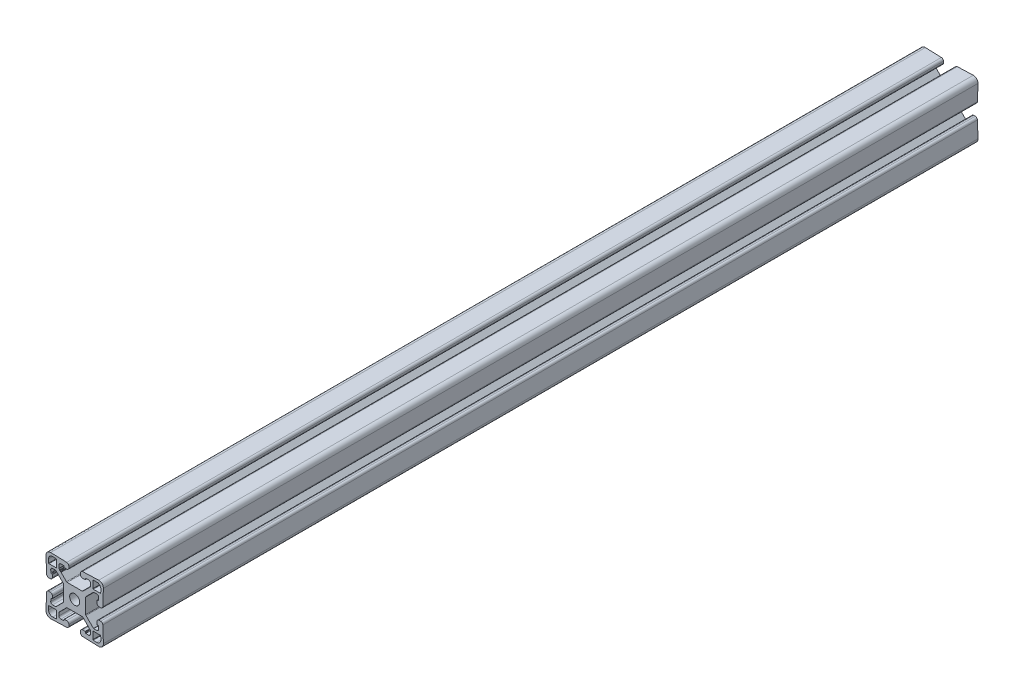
SolidWorks part; units mm, degrees
ref_plane "Front Plane" through (0, 0, 0) normal (0, 0, 1) x (1, 0, 0)
ref_plane "Top Plane" through (0, 0, 0) normal (0, 1, 0) x (1, 0, 0)
ref_plane "Right Plane" through (0, 0, 0) normal (1, 0, 0) x (0, 0, -1)
sketch "Sketch1" plane through (0, 0, 0) normal (0, 0, 1) x (1, 0, 0)
  line L0 (0, 0) -> (0, 20) construction
  line L1 (0, 0) -> (20, 0) construction
  line L2 (0, 0) -> (-20, 20) construction
  line L3 (-16.7142, 19.9981) -> (-5.5358, 19.6077)
  line L4 (-20, 20) -> (0, 20) construction
  line L5 (-4.064, 18.0836) -> (-4.064, 17.069)
  line L6 (-5.6422, 15.5449) -> (-7.1936, 15.5991)
  line L7 (-7.5, 15.9164) -> (-7.5, 16.3198)
  line L8 (-7.8064, 16.6371) -> (-9.6857, 16.7028)
  line L9 (-11, 15.4335) -> (-11, 13.2868)
  line L10 (0, 7.681) -> (-5.2101, 7.681)
  line L11 (-5.7489, 7.9042) -> (-10.907, 13.0623)
  line L12 (-7.9042, 5.7489) -> (-13.0623, 10.907)
  line L13 (-7.681, 0) -> (-7.681, 5.2101)
  line L14 (-15.4335, 11) -> (-13.2868, 11)
  line L15 (-16.6371, 7.8064) -> (-16.7028, 9.6857)
  line L16 (-15.9164, 7.5) -> (-16.3198, 7.5)
  line L17 (-15.5449, 5.6422) -> (-15.5991, 7.1936)
  line L18 (-18.0836, 4.064) -> (-17.069, 4.064)
  line L19 (-19.9981, 16.7142) -> (-19.6077, 5.5358)
  line L20 (-18.2207, 15.3309) -> (-18.1275, 12.661)
  line L21 (-15.3309, 18.2207) -> (-12.661, 18.1275)
  line L22 (-18.1275, 12.661) -> (-12.661, 12.661)
  line L23 (-12.661, 18.1275) -> (-12.661, 12.661)
  line L24 (0, 0) -> (-20, 0) construction
  line L25 (-20, 0) -> (0, 0) construction
  line L26 (0, 0) -> (0, -20) construction
  line L27 (-20, -20) -> (-20, 20) construction
  line L28 (0, 20) -> (20, 20) construction
  line L29 (0, -1000) -> (0, 49000)
  line L30 (-20, -20) -> (20, -20) construction
  arc A0 (-19.9981, 16.7142) -> (-16.7142, 19.9981) centre (-16.825, 16.825) cw
  arc A1 (-7.1936, 15.5991) -> (-7.5, 15.9164) centre (-7.1825, 15.9164) cw
  arc A2 (-7.5, 16.3198) -> (-7.8064, 16.6371) centre (-7.8175, 16.3198) ccw
  arc A3 (-9.6857, 16.7028) -> (-11, 15.4335) centre (-9.73, 15.4335) ccw
  arc A4 (-4.064, 17.069) -> (-5.6422, 15.5449) centre (-5.589, 17.069) cw
  arc A5 (-5.5358, 19.6077) -> (-4.064, 18.0836) centre (-5.589, 18.0836) cw
  arc A6 (-5.2101, 7.681) -> (-5.7489, 7.9042) centre (-5.2101, 8.443) cw
  arc A7 (-7.9042, 5.7489) -> (-7.681, 5.2101) centre (-8.443, 5.2101) cw
  arc A8 (-11, 13.2868) -> (-10.907, 13.0623) centre (-10.6825, 13.2868) ccw
  arc A9 (-18.0836, 4.064) -> (-19.6077, 5.5358) centre (-18.0836, 5.589) cw
  arc A10 (-15.5449, 5.6422) -> (-17.069, 4.064) centre (-17.069, 5.589) cw
  arc A11 (-15.9164, 7.5) -> (-15.5991, 7.1936) centre (-15.9164, 7.1825) cw
  arc A12 (-16.6371, 7.8064) -> (-16.3198, 7.5) centre (-16.3198, 7.8175) ccw
  arc A13 (-15.4335, 11) -> (-16.7028, 9.6857) centre (-15.4335, 9.73) ccw
  arc A14 (-13.0623, 10.907) -> (-13.2868, 11) centre (-13.2868, 10.6825) ccw
  arc A15 (-15.3309, 18.2207) -> (-18.2207, 15.3309) centre (-15.4284, 15.4284) ccw
  circle A16 centre (0, 0) radius 3.5
  point P26 (-7.5, 15.6098)
  point P29 (-7.5, 16.6264)
  point P32 (-11, 16.7487)
  point P35 (-4.064, 15.4898)
  point P38 (-4.064, 19.5563)
  point P42 (-5.5257, 7.681)
  point P45 (-7.681, 5.5257)
  point P48 (-11, 13.1553)
  point P51 (-19.5563, 4.064)
  point P54 (-15.4898, 4.064)
  point P57 (-15.6098, 7.5)
  point P60 (-16.6264, 7.5)
  point P63 (-16.7487, 11)
  point P66 (-13.1553, 11)
  point P80 (-20, 0)
  point P85 (0, -20)
  point P88 (0, -20)
sketch "Sketch2" plane through (0, 0, 0) normal (1, 0, 0) x (0, 0, -1)
  line L0 (-304.8, 0) -> (304.8, 0)
  line L1 (-304.8, -20) -> (-304.8, 20) construction
  line L2 (0, 0) -> (0, 20) construction
  line L3 (0, 0) -> (0, 20) construction
  line L4 (304.8, -20) -> (304.8, 20) construction
  point P0 (-244.8, 0)
  point P3 (0, 0)
  point P7 (244.8, 0)
  point P11 (-304.8, 0)
  point P14 (304.8, 0)
sketch "Sketch3" plane through (0, 0, 0) normal (0, 0, 1) x (1, 0, 0)
  line L0 (-7.681, 0) -> (-7.681, 5.2101) construction
  line L1 (-7.9042, 5.7489) -> (-13.0623, 10.907) construction
  line L2 (-15.4335, 11) -> (-13.2868, 11) construction
  line L3 (-16.6371, 7.8064) -> (-16.7028, 9.6857) construction
  line L4 (-18.2207, 15.3309) -> (-18.1275, 12.661)
  line L5 (-18.1275, 12.661) -> (-12.661, 12.661)
  line L6 (-12.661, 12.661) -> (-12.661, 18.1275)
  line L7 (-12.661, 18.1275) -> (-15.3309, 18.2207)
  line L8 (-18.2207, 15.3309) -> (-18.136, 12.9061)
  line L9 (-17.8822, 12.661) -> (-12.915, 12.661)
  line L10 (-12.661, 12.915) -> (-12.661, 17.8822)
  line L11 (-12.9061, 18.136) -> (-15.3309, 18.2207)
  line L12 (-15.9164, 7.5) -> (-16.3198, 7.5) construction
  line L13 (-15.5449, 5.6422) -> (-15.5991, 7.1936) construction
  line L14 (-18.0836, 4.064) -> (-17.069, 4.064) construction
  line L15 (-19.9981, 16.7142) -> (-19.6077, 5.5358) construction
  line L16 (-16.7142, 19.9981) -> (-5.5358, 19.6077) construction
  line L17 (-4.064, 18.0836) -> (-4.064, 17.069) construction
  line L18 (-5.6422, 15.5449) -> (-7.1936, 15.5991) construction
  line L19 (-7.5, 15.9164) -> (-7.5, 16.3198) construction
  line L20 (-7.8064, 16.6371) -> (-9.6857, 16.7028) construction
  line L21 (-11, 15.4335) -> (-11, 13.2868) construction
  line L22 (-5.7489, 7.9042) -> (-10.907, 13.0623) construction
  line L23 (0, 7.681) -> (-5.2101, 7.681) construction
  line L24 (-7.681, 0) -> (-7.681, 5.2101)
  line L25 (-7.9042, 5.7489) -> (-13.0623, 10.907)
  line L26 (-15.4335, 11) -> (-13.2868, 11)
  line L27 (-16.6371, 7.8064) -> (-16.7028, 9.6857)
  line L28 (-15.9164, 7.5) -> (-16.3198, 7.5)
  line L29 (-15.5449, 5.6422) -> (-15.5991, 7.1936)
  line L30 (-18.0836, 4.064) -> (-17.069, 4.064)
  line L31 (-19.9981, 16.7142) -> (-19.6077, 5.5358)
  line L32 (-16.7142, 19.9981) -> (-5.5358, 19.6077)
  line L33 (-4.064, 18.0836) -> (-4.064, 17.069)
  line L34 (-5.6422, 15.5449) -> (-7.1936, 15.5991)
  line L35 (-7.5, 15.9164) -> (-7.5, 16.3198)
  line L36 (-7.8064, 16.6371) -> (-9.6857, 16.7028)
  line L37 (-11, 15.4335) -> (-11, 13.2868)
  line L38 (-5.7489, 7.9042) -> (-10.907, 13.0623)
  line L39 (0, 7.681) -> (-5.2101, 7.681)
  line L40 (-7.681, 0) -> (-3.5, 0)
  line L41 (0, 3.5) -> (0, 7.681)
  arc A0 (-7.681, 5.2101) -> (-7.9042, 5.7489) centre (-8.443, 5.2101) ccw construction
  circle A1 centre (0, 0) radius 3.5
  arc A2 (0, 3.5) -> (-3.5, 0) centre (0, 0) ccw
  arc A3 (-15.3309, 18.2207) -> (-18.2207, 15.3309) centre (-15.4284, 15.4284) ccw
  arc A4 (-15.3309, 18.2207) -> (-18.2207, 15.3309) centre (-15.4284, 15.4284) ccw
  arc A5 (-13.0623, 10.907) -> (-13.2868, 11) centre (-13.2868, 10.6825) ccw construction
  arc A6 (-15.4335, 11) -> (-16.7028, 9.6857) centre (-15.4335, 9.73) ccw construction
  arc A7 (-16.6371, 7.8064) -> (-16.3198, 7.5) centre (-16.3198, 7.8175) ccw construction
  arc A8 (-15.5991, 7.1936) -> (-15.9164, 7.5) centre (-15.9164, 7.1825) ccw construction
  arc A9 (-17.069, 4.064) -> (-15.5449, 5.6422) centre (-17.069, 5.589) ccw construction
  arc A10 (-19.6077, 5.5358) -> (-18.0836, 4.064) centre (-18.0836, 5.589) ccw construction
  arc A11 (-16.7142, 19.9981) -> (-19.9981, 16.7142) centre (-16.825, 16.825) ccw construction
  arc A12 (-4.064, 18.0836) -> (-5.5358, 19.6077) centre (-5.589, 18.0836) ccw construction
  arc A13 (-5.6422, 15.5449) -> (-4.064, 17.069) centre (-5.589, 17.069) ccw construction
  arc A14 (-7.5, 15.9164) -> (-7.1936, 15.5991) centre (-7.1825, 15.9164) ccw construction
  arc A15 (-7.5, 16.3198) -> (-7.8064, 16.6371) centre (-7.8175, 16.3198) ccw construction
  arc A16 (-9.6857, 16.7028) -> (-11, 15.4335) centre (-9.73, 15.4335) ccw construction
  arc A17 (-11, 13.2868) -> (-10.907, 13.0623) centre (-10.6825, 13.2868) ccw construction
  arc A18 (-5.7489, 7.9042) -> (-5.2101, 7.681) centre (-5.2101, 8.443) ccw construction
  arc A19 (-7.681, 5.2101) -> (-7.9042, 5.7489) centre (-8.443, 5.2101) ccw
  arc A20 (-13.0623, 10.907) -> (-13.2868, 11) centre (-13.2868, 10.6825) ccw
  arc A21 (-15.4335, 11) -> (-16.7028, 9.6857) centre (-15.4335, 9.73) ccw
  arc A22 (-16.6371, 7.8064) -> (-16.3198, 7.5) centre (-16.3198, 7.8175) ccw
  arc A23 (-15.5991, 7.1936) -> (-15.9164, 7.5) centre (-15.9164, 7.1825) ccw
  arc A24 (-17.069, 4.064) -> (-15.5449, 5.6422) centre (-17.069, 5.589) ccw
  arc A25 (-19.6077, 5.5358) -> (-18.0836, 4.064) centre (-18.0836, 5.589) ccw
  arc A26 (-16.7142, 19.9981) -> (-19.9981, 16.7142) centre (-16.825, 16.825) ccw
  arc A27 (-4.064, 18.0836) -> (-5.5358, 19.6077) centre (-5.589, 18.0836) ccw
  arc A28 (-5.6422, 15.5449) -> (-4.064, 17.069) centre (-5.589, 17.069) ccw
  arc A29 (-7.5, 15.9164) -> (-7.1936, 15.5991) centre (-7.1825, 15.9164) ccw
  arc A30 (-7.5, 16.3198) -> (-7.8064, 16.6371) centre (-7.8175, 16.3198) ccw
  arc A31 (-9.6857, 16.7028) -> (-11, 15.4335) centre (-9.73, 15.4335) ccw
  arc A32 (-11, 13.2868) -> (-10.907, 13.0623) centre (-10.6825, 13.2868) ccw
  arc A33 (-5.7489, 7.9042) -> (-5.2101, 7.681) centre (-5.2101, 8.443) ccw
  arc A36 (-12.661, 17.8822) -> (-12.9061, 18.136) centre (-12.915, 17.8822) ccw
  arc A37 (-12.915, 12.661) -> (-12.661, 12.915) centre (-12.915, 12.915) ccw
  arc A38 (-18.136, 12.9061) -> (-17.8822, 12.661) centre (-17.8822, 12.915) ccw
  dimension "D3" = 0.254
  dimension "D1" = 0
  dimension "D2" = 0
extrude "Boss-Extrude1" add sketch "Sketch3" along normal mid plane 609.6
pattern_circular "CirPattern1" count 4 over 360 about axis through (0, 0, 0) along (0, 0, 1) of "Boss-Extrude1"
sketch "Sketch4" plane through (0, 0, 0) normal (0, 0, 1) x (1, 0, 0)
  line L1 (-10.5057, 12.661) -> (-9.5057, 12.661)
  line L8 (-5.7489, 7.9042) -> (-10.907, 13.0623) construction
  line L9 (-9.5057, 12.661) -> (-9.5057, 11.661)
  line L10 (-9.5057, 11.661) -> (-9.8391, 11.661)
  line L12 (-10.1724, 12.3277) -> (-9.8391, 11.9943)
  line L20 (-9.8391, 11.9943) -> (-9.8391, 12.3277) construction
  line L22 (-9.8391, 11.661) -> (-9.8391, 11.9943)
  line L23 (-9.8391, 12.3277) -> (-10.1724, 12.3277) construction
  line L25 (-10.1724, 12.3277) -> (-10.5057, 12.3277)
  line L26 (-10.5057, 12.3277) -> (-10.5057, 12.661)
  line L27 (-17.8822, 12.661) -> (-12.915, 12.661) construction
  dimension "D2" = 1
extrude "Cut-Extrude1" cut sketch "Sketch4" against normal through all both and the other way through all
ref_plane "Contact Plane 1" through (0, 20, 0) normal (0, 1, 0) x (1, 0, 0)
ref_plane "Contact Plane 2" through (20, 0, 0) normal (1, 0, 0) x (0, 0, -1)
ref_plane "Contact Plane 3" through (0, -20, 0) normal (0, -1, 0) x (-1, 0, 0)
ref_plane "Contact Plane 4" through (-20, 0, 0) normal (-1, 0, 0) x (0, 0, 1)
equation "\"D1@Sketch2\"=\"Rail Width@Sketch1\"*1.5"
equation "\"D1@Boss-Extrude1\"=\"Length@Sketch2\""
equation "\"ShaftDiameter\"= 12mm"
equation "\"PendulumDiameter\"=12mm"
equation "\"PendulumLength\"= 140mm"
equation "\"EncoderOuterDiameter\"=1.5"
equation "\"EncoderShaftDiameter\"= 6mm"
equation "\"EncoderShaftLength\"=15mm+.5in+3mm"
equation "\"PendulumHolderangle\"=60"
equation "\"PendulumholderBottomHeight\"= 75"
equation "\"PendulumholderBottomWidth\"= 75"
equation "\"PendulumholderHeight\"=25"
equation "\"BearingOutsideDiameter\"=21mm"
equation "\"PendulumHolderWidth\"= 100mm"
equation "\"ShaftHeightFromTSlot\"= 100mm"
equation "\"BearingThickness\"= 5mm"
equation "\"SlipRingOuterDiameter\"=56mm"
equation "\"SlipringBigThickness\"=25mm"
equation "\"SlipringSmallThickness\"=8.5mm"
equation "\"Tol\"=2mm"
equation "\"ScrewHole\"= 5mm"
equation "\"Tframwidth\"= 40mm"
equation "\"TFrameheight\"= 12in"
equation "\"Tframetotalwidth\"= 2ft"
equation "\"Length@Sketch2\"=\"Tframetotalwidth\""
